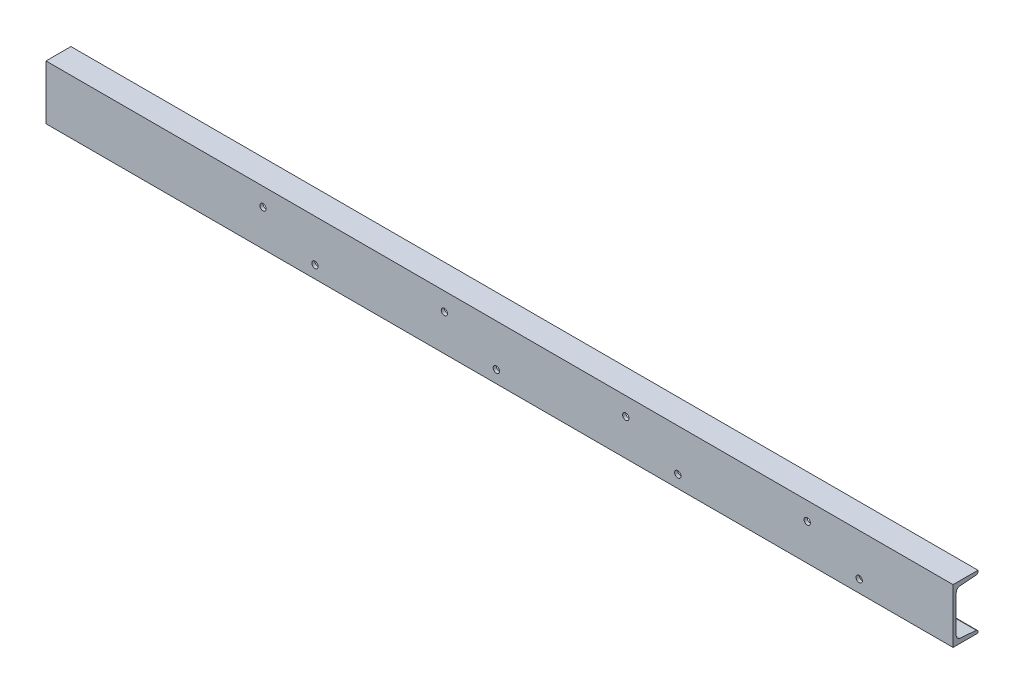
SolidWorks part; units mm, degrees
ref_plane "Płaszczyzna przednia" through (0, 0, 0) normal (0, 0, 1) x (1, 0, 0)
ref_plane "Płaszczyzna górna" through (0, 0, 0) normal (0, 1, 0) x (1, 0, 0)
ref_plane "Płaszczyzna prawa" through (0, 0, 0) normal (1, 0, 0) x (0, 0, -1)
sketch "Szkic1" plane through (0, 0, 0) normal (0, 0, 1) x (1, 0, 0)
  line L0 (0, 0) -> (2000, 0)
  dimension "D1" = 2000
other "Ceowniki UPN120(1)"
ref_plane "Płaszczyzna1" through (0, 0, 0) normal (-1, 0, 0) x (0, 0, -1)
sketch "Sketch1" plane through (0, 0, 0) normal (-1, 0, 0) x (0, 0, -1)
  line L0 (55, 120) -> (0, 120)
  line L1 (55, 0) -> (0, 0)
  line L2 (0, 120) -> (0, 0)
  line L5 (0, 9) -> (27.5, 9) construction
  line L6 (55, 120) -> (55, 117.3544)
  line L7 (55, 0) -> (55, 2.6456)
  line L12 (7, 101.0512) -> (7, 18.9488)
  line L17 (15.2823, 110.0226) -> (50.8589, 112.8687)
  line L18 (15.2823, 9.9774) -> (50.8589, 7.1313)
  arc A0 (50.8589, 112.8687) -> (55, 117.3544) centre (50.5, 117.3544) ccw
  arc A1 (50.8589, 7.1313) -> (55, 2.6456) centre (50.5, 2.6456) cw
  arc A9 (7, 18.9488) -> (15.2823, 9.9774) centre (16, 18.9488) ccw
  arc A10 (7, 101.0512) -> (15.2823, 110.0226) centre (16, 101.0512) cw
  point P10 (0, 60)
  point P11 (7, 60)
  point P12 (27.5, 120)
  point P13 (27.5, 0)
  point P14 (0, 0)
  dimension "D4" = 27.5
  dimension "RI" = 9
  dimension "D2" = 4.574
  dimension "RA" = 4.5
  dimension "Depth" = 120
  dimension "BF" = 55
  dimension "TW" = 7
  dimension "TF" = 9
hole_wizard "Otwór Ø14.0 (14)1" positions "Szkic3" profile "Szkic4" hole size "Ø14.0" standard "ISO"
sketch "Szkic3" plane through (0, 0, 0) normal (0, 0, 1) x (1, 0, 0)
  line L0 (469.4661, -40) -> (487.4661, -40) construction
  point P8 (478.4661, -40)
  point P14 (878.4661, -40)
  point P15 (1278.4661, -40)
  point P16 (1678.4661, -40)
  dimension "D2" = 400
  dimension "D1" = 4
sketch "Szkic4" plane through (1678.4661, -40, 0) normal (1, 0, 0) x (0, -1, 0)
  line L0 (0, 0) -> (0, 55)
  line L1 (0, 55) -> (7, 55)
  line L2 (7, 55) -> (7, 0)
  line L5 (7, 0) -> (0, 0)
  line L11 (0, -6.35) -> (0, 107.95) construction
  dimension "Średnica otworu na wylot" = 14
  dimension "Głębokość otworu na wylot" = 55
hole_wizard "Otwór Ø14.0 (14)11" positions "Szkic31" profile "Szkic41" hole size "Ø14.0" standard "ISO"
sketch "Szkic31" plane through (216.8687, 0, 0) normal (0, 0, 1) x (1, 0, 0)
  line L0 (252.5974, -40) -> (270.5974, -40) construction
  point P8 (261.5974, -40)
  point P14 (661.5974, -40)
  point P15 (1061.5974, -40)
  dimension "D2" = 400
  dimension "D1" = 3
sketch "Szkic41" plane through (1278.4661, -40, 0) normal (1, 0, 0) x (0, -1, 0)
  line L0 (0, 0) -> (0, 55)
  line L1 (0, 55) -> (7, 55)
  line L2 (7, 55) -> (7, 0)
  line L5 (7, 0) -> (0, 0)
  line L11 (0, -6.35) -> (0, 107.95) construction
  dimension "Średnica otworu na wylot" = 14
  dimension "Głębokość otworu na wylot" = 55
other "Inteligentna operacja1<Lzg_60x50x4_401-1>"
hole_wizard "Otwór Ø14.0 (14)13" positions "Szkic33" profile "Szkic43" hole size "Ø14.0" standard "ISO"
sketch "Szkic33" plane through (331.4456, -52.7744, 0) normal (0, 0, 1) x (1, 0, 0)
  line L0 (252.5974, -40) -> (270.5974, -40) construction
  point P8 (261.5974, -40)
  point P14 (661.5974, -40)
  point P15 (1061.5974, -40)
  point P16 (1461.5974, -40)
  dimension "D2" = 400
  dimension "D1" = 4
sketch "Szkic43" plane through (1793.043, -92.7744, 0) normal (1, 0, 0) x (0, -1, 0)
  line L0 (0, 0) -> (0, 7)
  line L1 (0, 7) -> (7, 7)
  line L2 (7, 7) -> (7, 0)
  line L5 (7, 0) -> (0, 0)
  line L11 (0, -6.35) -> (0, 107.95) construction
  dimension "Średnica otworu na wylot" = 14
  dimension "Głębokość otworu na wylot" = 7
other "Inteligentna operacja3<Lzg_60x50x4_401-2>"
